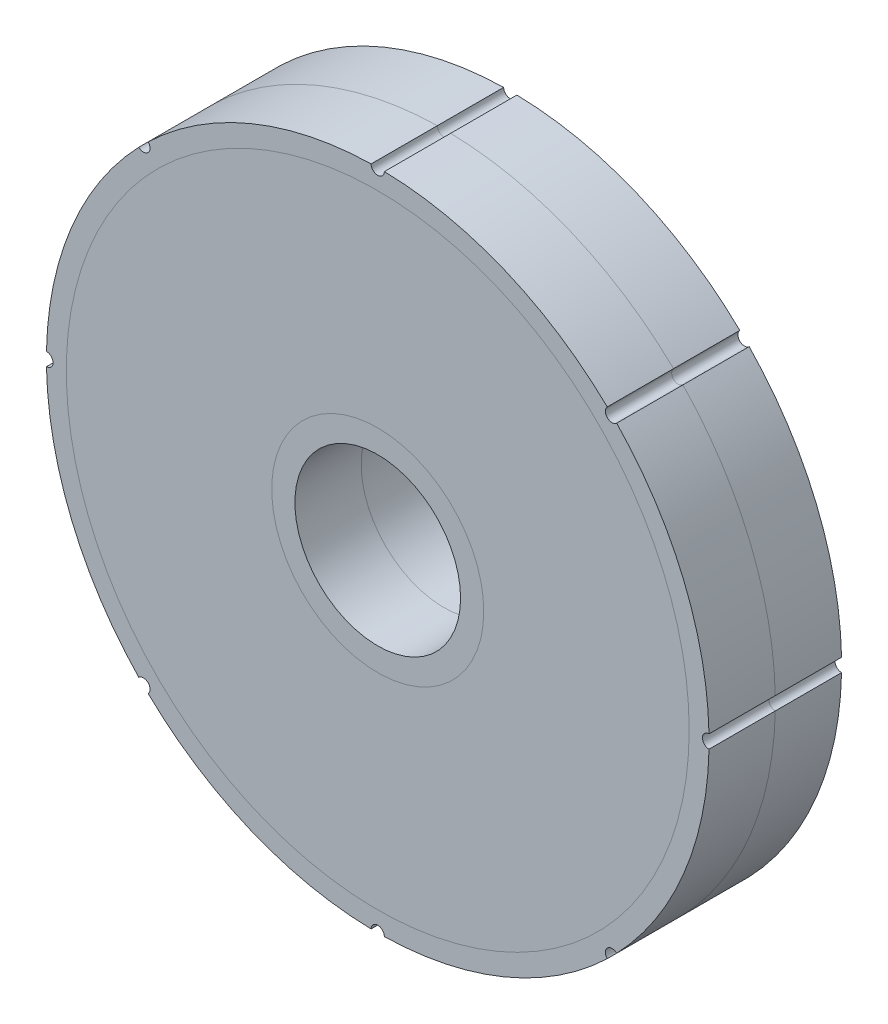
SolidWorks part; units mm, degrees
ref_plane "Front Plane" through (0, 0, 0) normal (0, 0, 1) x (1, 0, 0)
ref_plane "Top Plane" through (0, 0, 0) normal (0, 1, 0) x (1, 0, 0)
ref_plane "Right Plane" through (0, 0, 0) normal (1, 0, 0) x (0, 0, -1)
sketch "Sketch1" plane through (0, 0, 0) normal (0, 0, 1) x (1, 0, 0)
  circle A0 centre (0, 0) radius 50
  circle A1 centre (0, 0) radius 12.5
  dimension "D1" = 100
  dimension "D2" = 25
extrude "Boss-Extrude1" add sketch "Sketch1" along normal mid plane 20
sketch "Sketch2" plane through (0, 0, 10) normal (0, 0, 1) x (1, 0, 0)
  line L0 (0, 0) -> (-40.4422, 40.4422) construction
  line L1 (0, 0) -> (39.8756, 39.8756) construction
  line L2 (0, 0) -> (41.8775, -41.8775) construction
  line L3 (0, 0) -> (-42.3524, -42.3524) construction
  line L4 (0, 0) -> (-50, 0) construction
  circle A0 centre (0, 50) radius 1
  circle A1 centre (0, 0) radius 50 construction
  circle A2 centre (-50, 0) radius 1
  circle A3 centre (50, 0) radius 1
  circle A4 centre (0, -50) radius 1
  circle A5 centre (-35.3553, 35.3553) radius 1
  circle A6 centre (35.3553, 35.3553) radius 1
  circle A7 centre (35.3553, -35.3553) radius 1
  circle A8 centre (-35.3553, -35.3553) radius 1
  point P24 (0, 0)
  point P25 (0, 0)
  point P26 (0, 0)
  dimension "D1" = 2
  dimension "D2" = 2
  dimension "D3" = 2
  dimension "D4" = 2
  dimension "D6" = 2
  dimension "D7" = 2
  dimension "D8" = 2
  dimension "D9" = 2
  dimension "D5" = 45
extrude "Cut-Extrude1" cut sketch "Sketch2" against normal through all
sketch "Sketch3" plane through (0, 0, 10) normal (0, 0, 1) x (1, 0, 0)
  circle A0 centre (0, 0) radius 16
  circle A1 centre (0, 0) radius 47
  dimension "D1" = 94
  dimension "D2" = 32
split "Split1" trim tools "Sketch3" bodies to split 102 resulting bodies 103 104 105
ref_plane "Plane1" through (0, 0, 0) normal (0, 0, 1) x (1, 0, 0)
split "Split2" trim tools "Plane1" bodies to split 104 103 105 resulting bodies 106 107 108 109 110 111
ref_plane "Plane2" through (0, 0, 0) normal (1, 0, 0) x (0, 0, -1)
ref_plane "Plane3" through (0, 0, 0) normal (0, 1, 0) x (1, 0, 0)
ref_plane "Plane4" through (0, 0, 0) normal (-0.7071, 0.7071, 0) x (0.7071, 0.7071, 0)
ref_plane "Plane5" through (0, 0, 0) normal (-0.7071, -0.7071, 0) x (0, 0, 1)
